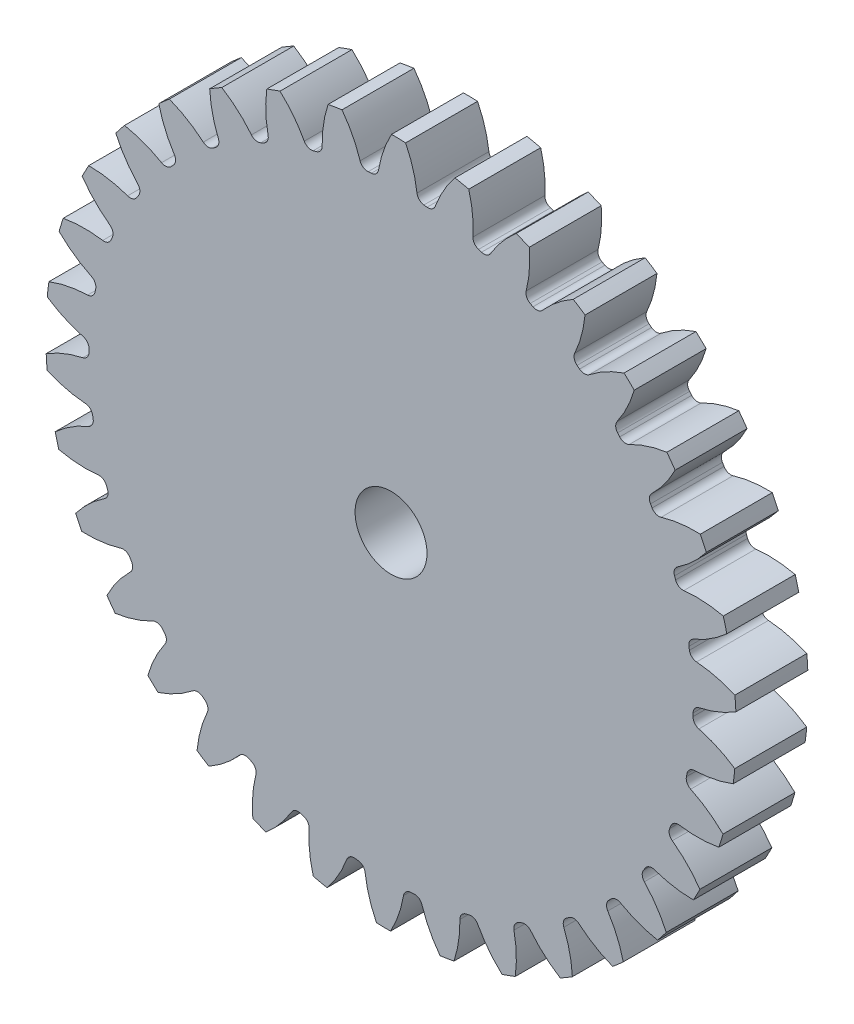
SolidWorks part; units mm, degrees
ref_plane "Front" through (0, 0, 0) normal (0, 0, 1) x (1, 0, 0)
ref_plane "Top" through (0, 0, 0) normal (0, 1, 0) x (1, 0, 0)
ref_plane "Right" through (0, 0, 0) normal (1, 0, 0) x (0, 0, -1)
sketch "Sketch3" plane through (0, 0, 0) normal (0, 0, 1) x (1, 0, 0)
  circle A0 centre (0, 0) radius 609.6
  dimension "od" = 1219.2
extrude "gearBody" add sketch "Sketch3" along normal blind 127
sketch "Sketch2" plane through (0, 0, 0) normal (0, 0, 1) x (1, 0, 0)
  line L0 (0, 0) -> (499.8303, 207.0365) construction
  line L1 (607.6618, -57.6346) -> (0, 0) construction
  line L2 (0, 0) -> (36.3143, 0) construction
  line L3 (575.565, 13.9198) -> (574.4069, -39.0594) construction
  line L5 (574.9859, -12.5698) -> (0, 0) construction
  line L7 (0, 0) -> (541.0124, 0) construction
  arc A0 (540.9995, 3.7266) -> (540.3198, -27.3654) centre (0, 0) ccw construction
  arc A1 (608.8341, 30.5485) -> (606.9174, -57.1262) centre (0, 0) ccw construction
  arc A2 (575.565, 13.9198) -> (574.4069, -39.0594) centre (0, 0) ccw construction
  arc A3 (533.2037, -14.4716) -> (533.3267, -8.8439) centre (0, 0) ccw
  arc A4 (607.6618, -57.6346) -> (543.4509, -28.1692) centre (490.305, -228.6819) ccw
  arc A5 (607.6618, -57.6346) -> (609.6, 31.0239) centre (0, 0) ccw
  arc A6 (609.6, 31.0239) -> (544.1627, 4.3928) centre (499.8303, 207.0365) cw
  arc A7 (533.3267, -8.8439) -> (544.1627, 4.3928) centre (547.1085, -9.0725) cw
  arc A8 (543.4509, -28.1692) -> (533.2037, -14.4716) centre (546.9823, -14.8455) cw
  point P6 (609.6, 31.0239)
  point P22 (607.6618, -57.6346)
  dimension "baseDia" = 1082.0247
  dimension "od" = 1219.2
  dimension "pd" = 1151.4667
  dimension "rd" = 1066.8
  dimension "rFillet" = 13.7837
  dimension "pointX" = 609.6
  dimension "pointY" = 31.0239
  dimension "CTT" = 52.9791
  dimension "flankCenterAngle" = 22.5
extrude "toothCut" cut sketch "Sketch2" along normal through all
pattern_circular "CirPattern1" count 34 over 360 about axis through (0, 0, 0) along (0, 0, 1) of "toothCut"
sketch "hub1Dia" plane through (0, 0, 0) normal (0, 0, -1) x (-1, 0, 0)
  circle A0 centre (0, 0) radius 12.7
  dimension "hub1Dia" = 25.4
sketch "hub2Dia" plane through (0, 0, 127) normal (0, 0, 1) x (1, 0, 0)
  circle A0 centre (0, 0) radius 12.7
  dimension "hub2dia" = 25.4
sketch "boreDia" plane through (0, 0, 0) normal (0, 0, 1) x (1, 0, 0)
  circle A0 centre (0, 0) radius 63.5
  dimension "boreDia" = 127
extrude "bore" cut sketch "boreDia" against normal mid plane 25400
